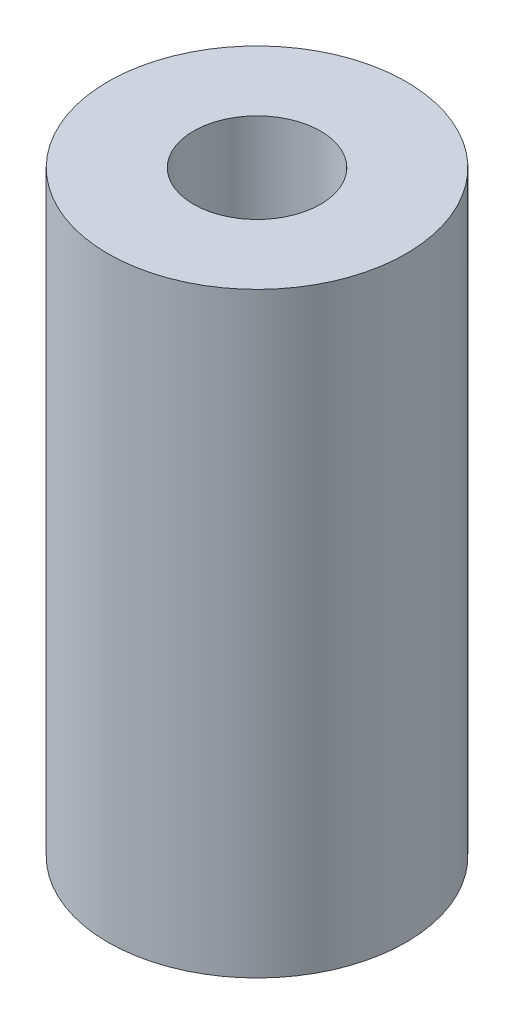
SolidWorks part; units mm, degrees
ref_plane "Front Plane" through (0, 0, 0) normal (0, 0, 1) x (1, 0, 0)
ref_plane "Top Plane" through (0, 0, 0) normal (0, 1, 0) x (1, 0, 0)
ref_plane "Right Plane" through (0, 0, 0) normal (1, 0, 0) x (0, 0, -1)
sketch "Sketch1" plane through (0, 0, 0) normal (0, 1, 0) x (1, 0, 0)
  circle A0 centre (0, 0) radius 3.175
  dimension "D1" = 6.35
extrude "Boss-Extrude1" add sketch "Sketch1" along normal blind 12.7
hole_wizard "#6-32 Tapped Hole1" positions "Sketch3" profile "Sketch4" tap size "#6-32" standard "Ansi Inch"
sketch "Sketch3" plane through (0, 12.7, 0) normal (0, 1, 0) x (-1, 0, 0)
  circle A0 centre (0, 0) radius 3.175 construction
  point P0 (0, 0)
  dimension "D1" = 0
sketch "Sketch4" plane through (0, 12.7, 0) normal (1, 0, 0) x (0, 0, 1)
  line L0 (0, 0) -> (0, 12.7)
  line L1 (0, 12.7) -> (1.3525, 12.7)
  line L2 (1.3525, 12.7) -> (1.3525, 0)
  line L5 (1.3525, 0) -> (0, 0)
  line L11 (0, -6.35) -> (0, 107.95) construction
  dimension "Thru Tap Drill Dia." = 2.7051
  dimension "Thru Tap Drill Depth" = 12.7
